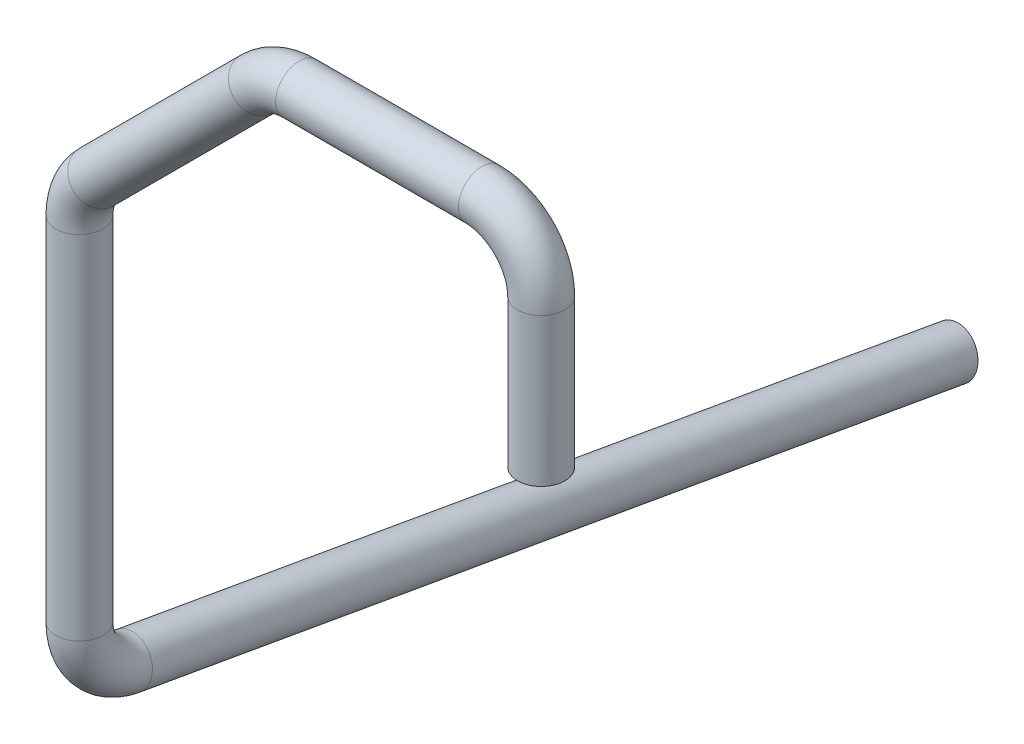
SolidWorks part; units mm, degrees
ref_plane "Front" through (0, 0, 0) normal (0, 0, 1) x (1, 0, 0)
ref_plane "Top" through (0, 0, 0) normal (0, 1, 0) x (1, 0, 0)
ref_plane "Right" through (0, 0, 0) normal (1, 0, 0) x (0, 0, -1)
sketch "Sketch6" plane through (0, 0, 0) normal (0, 0, 1) x (1, 0, 0)
  line L0 (0, 0) -> (0, 25)
  line L1 (-10, 35) -> (-40.8579, 35)
  line L2 (-47.9289, 32.0711) -> (-75.0711, 4.9289)
  line L3 (-78, -2.1421) -> (-78, -70)
  arc A0 (0, 25) -> (-10, 35) centre (-10, 25) ccw
  arc A1 (-75.0711, 4.9289) -> (-78, -2.1421) centre (-68, -2.1421) ccw
  arc A2 (-40.8579, 35) -> (-47.9289, 32.0711) centre (-40.8579, 25) ccw
  point P6 (0, 35)
  point P13 (-45, 35)
  dimension "D3" = 10
  dimension "D7" = 10
  dimension "D1" = 35
  dimension "D2" = 45
  dimension "D4" = 78
  dimension "D5" = 45
  dimension "D6" = 105
sketch "Sketch7" plane through (0, 0, 0) normal (0, 1, 0) x (1, 0, 0)
  circle A0 centre (0, 0) radius 4
  circle A1 centre (0, 0) radius 3.5
  dimension "D1" = 8
  dimension "D2" = 0.5
sketch3d "3DSketch2"
  line L0 (-78, -2.1421, 0) -> (-78, -70, 0) construction
  line L1 (-47.9289, 32.0711, 0) -> (-75.0711, 4.9289, 0) construction
  line L2 (-10, 35, 0) -> (-40.8579, 35, 0) construction
  line L3 (0, 0, 0) -> (0, 25, 0) construction
  line L4 (-78, -2.1421, 0) -> (-78, -61.609, 0)
  line L5 (-47.9289, 32.0711, 0) -> (-75.0711, 4.9289, 0)
  line L6 (-10, 35, 0) -> (-40.8579, 35, 0)
  line L7 (0, 0, 0) -> (0, 25, 0)
  line L8 (-78, -71.4571, -8.2635) -> (-78, -96.0472, -147.7212)
  line L9 (-78, -70, 0) -> (-78, -70, -20.9252) construction
  line L10 (0, 0, 0) -> (0, -70, 0) construction
  line L11 (0, -70, 0) -> (-78, -70, 0) construction
  arc A0 (-75.0711, 4.9289, 0) -> (-78, -2.1421, 0) centre (-68, -2.1421, 0) ccw construction
  arc A1 (-40.8579, 35, 0) -> (-47.9289, 32.0711, 0) centre (-40.8579, 25, 0) ccw construction
  arc A2 (0, 25, 0) -> (-10, 35, 0) centre (-10, 25, 0) ccw construction
  arc A3 (-75.0711, 4.9289, 0) -> (-78, -2.1421, 0) centre (-68, -2.1421, 0) ccw
  arc A4 (-40.8579, 35, 0) -> (-47.9289, 32.0711, 0) centre (-40.8579, 25, 0) ccw
  arc A5 (0, 25, 0) -> (-10, 35, 0) centre (-10, 25, 0) ccw
  arc A6 (-78, -61.609, 0) -> (-78, -71.4571, -8.2635) centre (-78, -61.609, -10) ccw
  point P5 (-68, -2.1421, 10)
  point P9 (-40.8579, 25, 10)
  point P13 (-10, 25, 10)
  point P14 (-68, -2.1421, 10)
  point P15 (-40.8579, 25, 10)
  point P16 (-10, 25, 10)
  point P24 (-78, -70, 0)
  point P26 (-68, -61.609, -10)
  dimension "D3" = 10
  dimension "D1" = 10
  dimension "D2" = 90
  dimension "D4" = 150
sweep "Sweep4" add profiles "Sketch7" path "3DSketch2"
